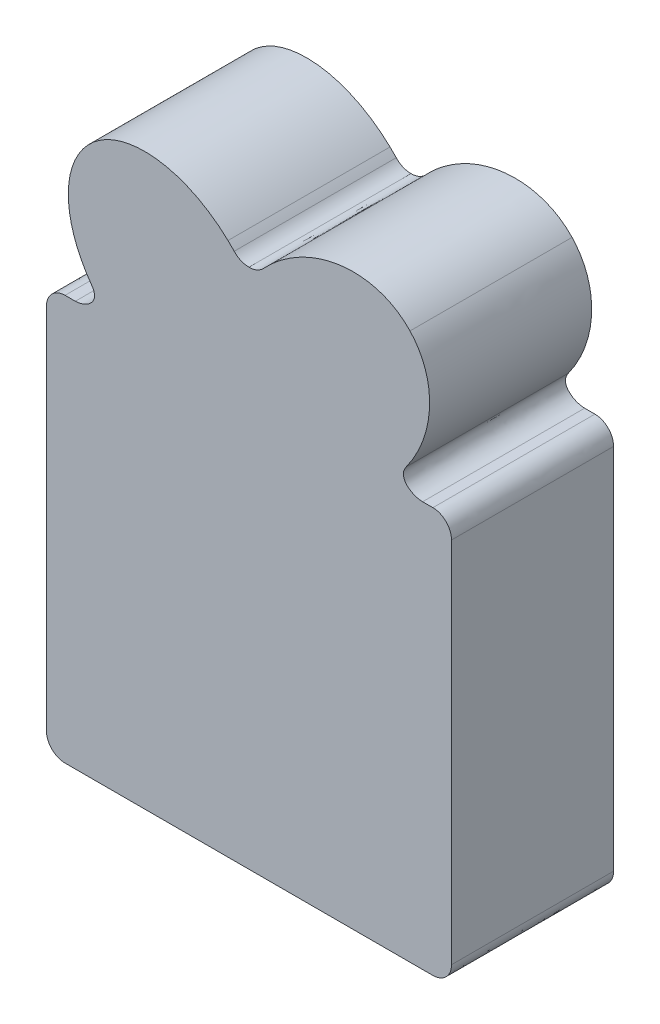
SolidWorks part; units mm, degrees
ref_plane "Front Plane" through (0, 0, 0) normal (0, 0, 1) x (1, 0, 0)
ref_plane "Top Plane" through (0, 0, 0) normal (0, 1, 0) x (1, 0, 0)
ref_plane "Right Plane" through (0, 0, 0) normal (1, 0, 0) x (0, 0, -1)
sketch "Sketch1" plane through (0, 0, 0) normal (0, 0, 1) x (1, 0, 0)
  line L0 (498.7723, 290.1953) -> (516.9305, 290.1953)
  line L1 (498.7723, 310.1953) -> (499.2796, 310.1953)
  line L2 (516.4232, 310.1953) -> (516.9305, 310.1953)
  spline S0 degree 3 poles (516.9305, 290.1953) (517.437, 290.1953) (517.8514, 290.6097) (517.8514, 291.1162) knots 0.05 0.05 0.05 0.05 0.1 0.1 0.1 0.1
  spline S1 degree 2 poles (517.8514, 291.1162) (517.8514, 291.1162) (517.8514, 309.2744) knots 0.1 0.1 0.1 0.15 0.15 0.15
  spline S2 degree 3 poles (517.8514, 309.2744) (517.8514, 309.7809) (517.437, 310.1953) (516.9305, 310.1953) knots 0.15 0.15 0.15 0.15 0.2 0.2 0.2 0.2
  spline S3 degree 3 poles (516.4232, 310.1953) (515.9046, 310.1953) (515.164, 310.6644) (515.6147, 311.2837) knots 0.25 0.25 0.25 0.25 0.3 0.3 0.3 0.3
  spline S4 degree 3 poles (515.6147, 311.2837) (517.0514, 313.258) (517.1874, 315.7155) (515.801, 317.1867) knots 0.3 0.3 0.3 0.3 0.35 0.35 0.35 0.35
  spline S5 degree 3 poles (515.801, 317.1867) (514.1778, 318.9092) (511.0816, 318.6288) (508.8866, 316.5603) knots 0.35 0.35 0.35 0.35 0.4 0.4 0.4 0.4
  spline S6 degree 3 poles (508.8866, 316.5603) (508.7809, 316.4606) (508.6783, 316.3578) (508.5807, 316.2538) knots 0.4 0.4 0.4 0.4 0.45 0.45 0.45 0.45
  spline S7 degree 3 poles (508.5807, 316.2538) (508.3849, 316.045) (508.138, 315.938) (507.8514, 315.938) knots 0.45 0.45 0.45 0.45 0.5 0.5 0.5 0.5
  spline S8 degree 3 poles (507.8514, 315.938) (507.5648, 315.938) (507.3179, 316.045) (507.1221, 316.2538) knots 0.5 0.5 0.5 0.5 0.55 0.55 0.55 0.55
  spline S9 degree 3 poles (507.1221, 316.2538) (507.0245, 316.3578) (506.9219, 316.4607) (506.8162, 316.5603) knots 0.55 0.55 0.55 0.55 0.6 0.6 0.6 0.6
  spline S10 degree 3 poles (506.8162, 316.5603) (504.6213, 318.6288) (501.5251, 318.9092) (499.9018, 317.1867) knots 0.6 0.6 0.6 0.6 0.65 0.65 0.65 0.65
  spline S11 degree 3 poles (499.9018, 317.1867) (498.5154, 315.7154) (498.6513, 313.2579) (500.0881, 311.2837) knots 0.65 0.65 0.65 0.65 0.7 0.7 0.7 0.7
  spline S12 degree 3 poles (500.0881, 311.2837) (500.5387, 310.6644) (499.7983, 310.1953) (499.2796, 310.1953) knots 0.7 0.7 0.7 0.7 0.75 0.75 0.75 0.75
  spline S13 degree 3 poles (498.7723, 310.1953) (498.2658, 310.1953) (497.8514, 309.7809) (497.8514, 309.2744) knots 0.8 0.8 0.8 0.8 0.85 0.85 0.85 0.85
  spline S14 degree 2 poles (497.8514, 309.2744) (497.8514, 309.2744) (497.8514, 291.1162) knots 0.85 0.85 0.85 0.9 0.9 0.9
  spline S15 degree 3 poles (497.8514, 291.1162) (497.8514, 290.6097) (498.2658, 290.1953) (498.7723, 290.1953) knots 0.9 0.9 0.9 0.9 1 1 1 1
extrude "Boss-Extrude1" add sketch "Sketch1" along normal blind 8
